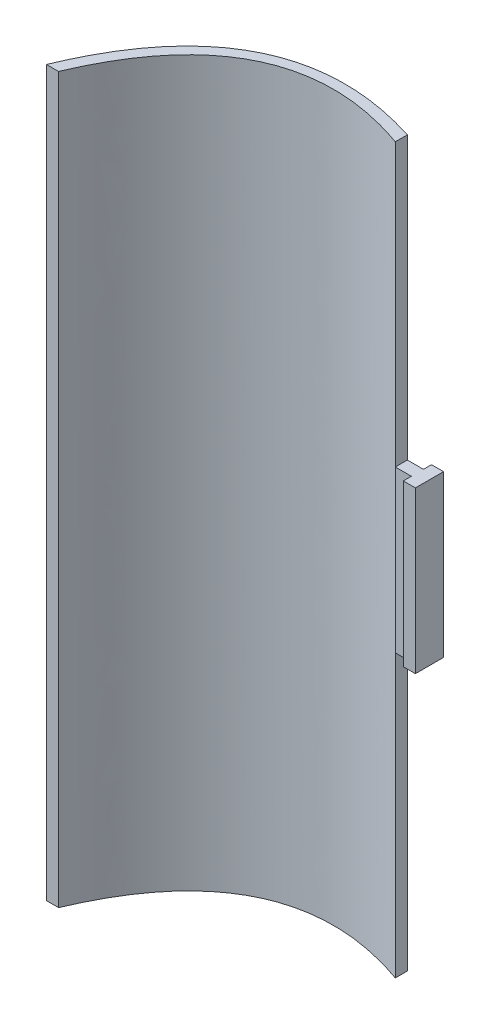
SolidWorks part; units mm, degrees
ref_plane "Front Plane" through (0, 0, 0) normal (0, 0, 1) x (1, 0, 0)
ref_plane "Top Plane" through (0, 0, 0) normal (0, 1, 0) x (1, 0, 0)
ref_plane "Right Plane" through (0, 0, 0) normal (1, 0, 0) x (0, 0, -1)
sketch "Sketch10" plane through (0, 0, 0) normal (0, 1, 0) x (1, 0, 0)
  line L0 (0, 21.3964) -> (0, 18.3964)
  line L1 (-60, -8.3075) -> (-57, -8.3075)
  line L2 (0, 21.3964) -> (-63.1351, 21.3964) construction
  line L3 (-60, -8.3075) -> (-60, 21.3964) construction
  spline S0 degree 2 poles (0, 21.3964) (-42.1956, 34.883) (-60, -8.3075) knots 0 0 0 1 1 1
  spline S1 degree 2 poles (0, 18.3964) (-39.7656, 32.5574) (-57, -8.3075) knots 0 0 0 1 1 1
sketch "Sketch19" plane through (0, 0, 0) normal (0, 0, 1) x (1, 0, 0)
  line L0 (-24.2315, 0) -> (-24.2315, 180) construction
  line L1 (0, 0) -> (-63.1351, 0) construction
ref_plane "Plane4" through (0, 180, 0) normal (0, 1, 0) x (1, 0, 0)
sketch "Sketch20" plane through (0, 180, 0) normal (0, 1, 0) x (1, 0, 0)
  line L0 (0, 21.3964) -> (0, 18.3964) construction
  line L1 (-60, -8.3075) -> (-57, -8.3075) construction
  line L2 (0, 21.3964) -> (0, 18.3964)
  line L3 (-60, -8.3075) -> (-57, -8.3075)
  parabola Q0 construction
  parabola Q1 construction
  parabola Q2
  parabola Q3
loft "BodyOfTheBlade" add profiles "Sketch20", "Sketch10"
sketch "Sketch21" plane through (0, 0, 0) normal (0, 0, 1) x (1, 0, 0)
  line L0 (-28.5, 0) -> (-28.5, 90) construction
  line L1 (-57, 0) -> (0, 0) construction
ref_plane "MidPlane" through (0, 90, 0) normal (0, 1, 0) x (1, 0, 0)
sketch "Sketch22" plane through (0, 90, 0) normal (0, 1, 0) x (1, 0, 0)
  line L0 (4, 18.3964) -> (4, 16.3964)
  line L1 (0, 21.3964) -> (4, 21.3964)
  line L2 (0, 21.3964) -> (0, 18.3964)
  line L3 (0, 18.3964) -> (4, 18.3964)
  line L5 (4, 23.3964) -> (7, 23.3964)
  line L6 (4, 23.3964) -> (4, 21.3964)
  line L7 (4, 16.3964) -> (7, 16.3964)
  line L8 (7, 23.3964) -> (7, 16.3964)
extrude "Joints" add sketch "Sketch22" along normal mid plane 40
equation "\"ExternalDiameterBallBearing\" = 22mm"
equation "\"InternalDiameterBallBearing\"= 8mm"
equation "\"HeightJoints\"= 40mm"
equation "\"WidthJoints\"= 3mm"
equation "\"DeepnessJoints\"= 60mm"
equation "\"TurbineShaftDiameter\"= 40mm"
equation "\"HeightTurbine\"= 180mm"
equation "\"HeightBlade\"= 180mm"
equation "\"HeightBallBearing\"= 7mm"
equation "\"D1@Sketch10\"=\"WidthJoints\""
equation "\"LenghtJoints\"= 7mm"
equation "\"D2@Sketch10\"=\"LenghtBlade\""
equation "\"LenghtBlade\"= 60mm"
equation "\"D1@Sketch19\"=\"HeightBlade\""
equation "\"D1@Sketch21\"=\"HeightBlade\"/2"
equation "\"D1@Sketch22\"=\"WidthJoints\"+\"ErrorForJointsBlade\""
equation "\"D2@Sketch22\"=\"WidthJoints\""
equation "\"D3@Sketch22\"=\"LenghtJoints\""
equation "\"D4@Sketch22\"=\"WidthJoints\""
equation "\"D1@Joints\" = \"HeightJoints\""
equation "\"Widthblade\"= 3mm"
equation "\"HeightBase\"= 20mm"
equation "\"HeightBox\"= 40mm"
equation "\"Lsqare\"= 90mm"
equation "\"lenghtJointsForBox\"=30mm"
equation "\"D3@Sketch10\"=\"WidthJoints\""
equation "\"ErrorForJoints1\"=0.6mm"
equation "\"ErrorForJoints2\"=0.4mm"
equation "\"ErrorForJointsBlade\"=1mm"
